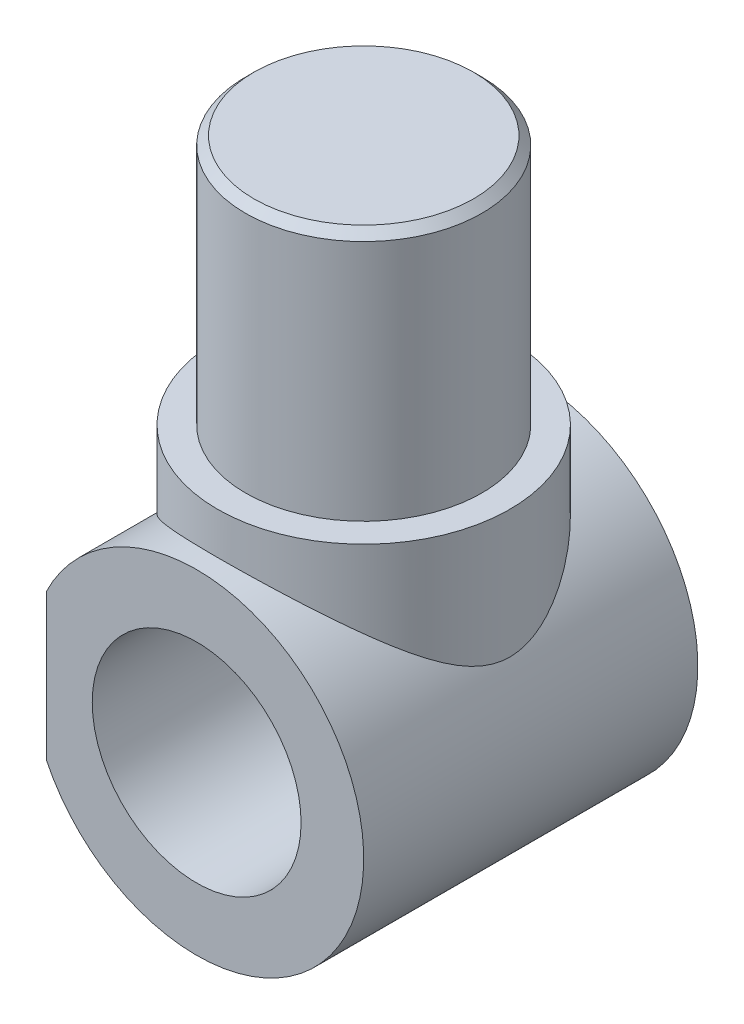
SolidWorks part; units mm, degrees
ref_plane "Plane1" through (0, 0, 0) normal (0, 0, 1) x (1, 0, 0)
ref_plane "Plane2" through (0, 0, 0) normal (0, 1, 0) x (1, 0, 0)
ref_plane "Plane3" through (0, 0, 0) normal (1, 0, 0) x (0, 0, -1)
sketch "Esquisse1" plane through (0, 0, 0) normal (0, 0, 1) x (1, 0, 0)
  circle A0 centre (0, 0) radius 20
  circle A1 centre (0, 0) radius 12.5
  dimension "D1" = 25
  dimension "D2" = 40
extrude "Base-Extrusion" add sketch "Esquisse1" along normal mid plane 40
ref_plane "Plan5" through (0, 55, 0) normal (0, 1, 0) x (-1, 0, 0)
sketch "Esquisse3" plane through (0, 55, 0) normal (0, 1, 0) x (-1, 0, 0)
  circle A0 centre (0, 0) radius 14.1421
extrude "Boss.-Extru.2" add sketch "Esquisse3" along normal up to surface (35 mm away)
ref_plane "Plan7" through (0, 25, 0) normal (0, 1, 0) x (-1, 0, 0)
sketch "Esquisse4" plane through (0, 25, 0) normal (0, 1, 0) x (-1, 0, 0)
  circle A0 centre (0, 0) radius 17.5
  dimension "D1" = 35
extrude "Boss.-Extru.3" add sketch "Esquisse4" along normal up to surface (5 mm away)
chamfer "Chanfrein2" distance 1 angle 45
sketch "Esquisse5" plane through (0, 0, 20) normal (0, 0, 1) x (1, 0, 0)
  line L0 (0, 20.1601) -> (0, -20) construction
  line L1 (-28, 10) -> (-18, 10)
  line L2 (-28, 10) -> (-28, -20)
  line L3 (-28, -20) -> (-18, -20)
  line L4 (-18, 10) -> (-18, -20)
  line L5 (0, -30.464) -> (0, 0.9249) construction
  dimension "D1" = 18
extrude "Enlèv. mat.-Extru.1" cut sketch "Esquisse5" against normal through all
